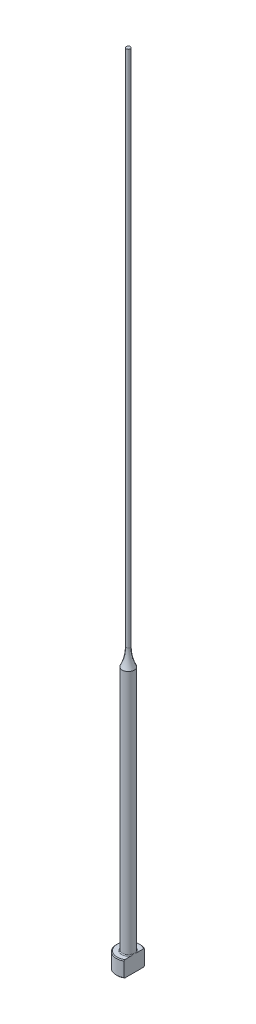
SolidWorks part; units mm, degrees
ref_plane "Front Plane" through (0, 0, 0) normal (0, 0, 1) x (1, 0, 0)
ref_plane "Top Plane" through (0, 0, 0) normal (0, 1, 0) x (1, 0, 0)
ref_plane "Right Plane" through (0, 0, 0) normal (1, 0, 0) x (0, 0, -1)
sketch "Sketch1" plane through (0, 0, 0) normal (0, 0, 1) x (1, 0, 0)
  line L0 (0, 259.9588) -> (0, -15.1925) construction
  line L1 (0, 0) -> (-3, 0)
  line L2 (-3, 0) -> (-3, 4)
  line L3 (-3, 4) -> (-1.5, 4)
  line L4 (-0.5, 70) -> (-0.5, 200)
  line L5 (-0.5, 200) -> (0, 200)
  line L6 (0, 200) -> (0, 0)
  line L7 (-1.5, 4) -> (-1.5, 65.6411)
  arc A0 (-1.5, 65.6411) -> (-0.5, 70) centre (-10.5, 70) ccw
  point P13 (-1.5, 0)
  dimension "D1" = 10
  dimension "L" = 200
  dimension "H" = 6
  dimension "T" = 4
  dimension "D" = 1
  dimension "B" = 3
  dimension "S" = 70
revolve "Revolve1" add sketch "Sketch1" angle 360 about L0
chamfer "Chamfer1" distance 0.2 angle 45 2 edges at (0, 4, 3) (0, 0, 3)
fillet "Fillet1" radius 0.2 1 edges at (0, 4, 1.5)
sketch "Sketch2" plane through (0, 0, 0) normal (0, 1, 0) x (1, 0, 0)
  line L0 (1.5, -2.5981) -> (1.5, 2.5981)
  circle A0 centre (0, 0) radius 3 construction
  arc A1 (1.5, -2.5981) -> (1.5, 2.5981) centre (0, 0) ccw
  circle A2 centre (0, 0) radius 1.5 construction
extrude "Keyed Head" cut sketch "Sketch2" along normal through all
